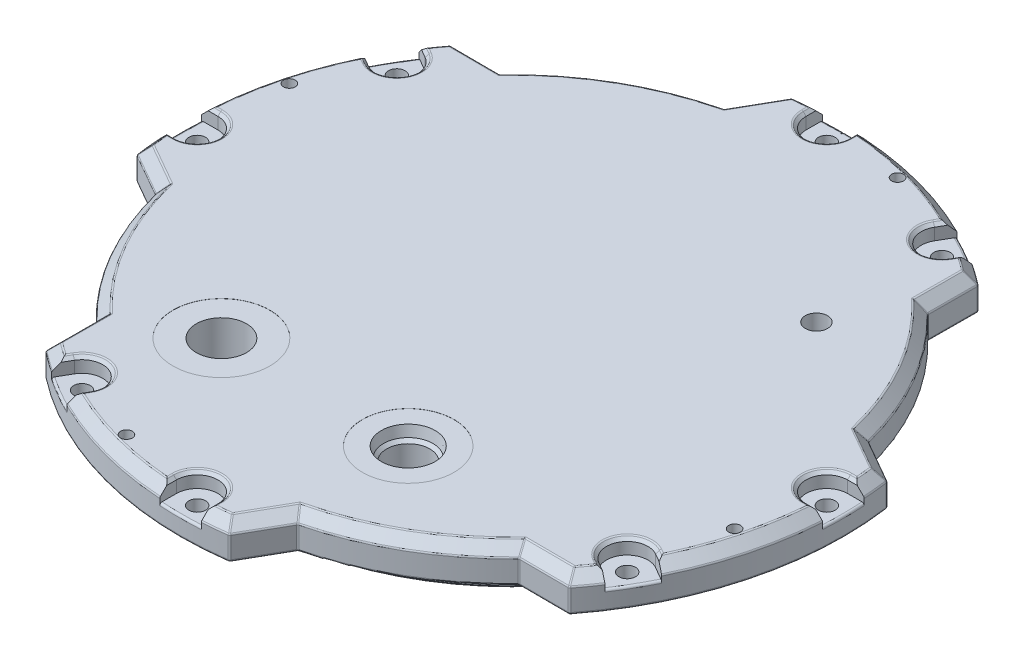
SolidWorks part; units mm, degrees
ref_plane "Front Plane" through (0, 0, 0) normal (0, 0, 1) x (1, 0, 0)
ref_plane "Top Plane" through (0, 0, 0) normal (0, 1, 0) x (1, 0, 0)
ref_plane "Right Plane" through (0, 0, 0) normal (1, 0, 0) x (0, 0, -1)
sketch "Sketch1" plane through (0, 0, 0) normal (0, 0, 1) x (1, 0, 0)
  line L0 (0, 0) -> (0, 13.4937)
  line L1 (0, 13.4937) -> (76.2, 13.4937)
  line L2 (76.2, 13.4937) -> (76.2, 5.5562)
  line L3 (76.2, 5.5562) -> (60.2996, 5.5562)
  line L4 (60.2996, 5.5562) -> (60.2996, 0)
  line L5 (60.2996, 0) -> (55.5625, 0)
  line L6 (0, 0) -> (0, -19.4139) construction
  line L7 (55.5625, 0) -> (53.2417, 0)
  line L8 (53.2417, 0) -> (0, 0)
  dimension "D1" = 152.4
  dimension "D2" = 120.5992
  dimension "D3" = 13.4937
  dimension "D4" = 7.9375
  dimension "D6" = 55.5625
revolve "Revolve1" add sketch "Sketch1" angle 360 about L6
ref_plane "Plane1" through (0, 0, 0) normal (0, 0, 1) x (1, 0, 0)
sketch "Sketch3" plane through (0, 0, 0) normal (0, 0, 1) x (1, 0, 0)
  line L0 (59.2869, 3.989) -> (60.2996, 4.0776)
  line L1 (60.2996, 4.0776) -> (60.2996, 1.4977)
  line L2 (60.2996, 1.4977) -> (59.2869, 1.5863)
  line L3 (59.055, 1.8393) -> (59.055, 3.736)
  line L4 (0, 50) -> (0, -50) construction
  line L5 (60.2996, 0) -> (60.2996, 5.5562) construction
  line L6 (59.2869, 3.989) -> (59.055, 3.9687) construction
  line L7 (59.2869, 1.5863) -> (59.055, 1.6065) construction
  line L8 (59.055, 1.8393) -> (59.055, 1.6065) construction
  line L9 (59.055, 3.736) -> (59.055, 3.9687) construction
  line L10 (59.055, 3.9687) -> (62.6971, 3.9687) construction
  line L11 (59.055, 1.6065) -> (62.6971, 1.6065) construction
  line L12 (-76.2, 5.5562) -> (76.2, 5.5562) construction
  line L13 (-60.2996, 0) -> (60.2996, 0) construction
  arc A0 (59.2869, 1.5863) -> (59.055, 1.8393) centre (59.309, 1.8393) cw
  arc A1 (59.055, 3.736) -> (59.2869, 3.989) centre (59.309, 3.736) cw
  dimension "D6" = 0.254
  dimension "D1" = 118.11
  dimension "D2" = 2.3622
  dimension "D3" = 1.6065
  dimension "D4" = 5
  dimension "D5" = 10
  dimension "D7" = 1.5875
revolve "Groove for AS 568-046, O-Ring1" cut sketch "Sketch3"
sketch "Sketch11" plane through (0, 0, 0) normal (0, 0, 1) x (1, 0, 0)
  line L0 (-76.2, 5.5562) -> (76.2, 5.5562) construction
  line L1 (63.3603, 5.5562) -> (65.9257, 5.5562)
  line L2 (63.3603, 5.5562) -> (63.3603, 6.8262)
  line L3 (63.3603, 6.8262) -> (65.9257, 6.8262)
  line L4 (65.9257, 5.5562) -> (65.9257, 6.8262)
  line L5 (0, 0) -> (0, -14.4596) construction
  line L6 (0, 37.2738) -> (0, -63.3395) construction
  line L7 (0, 5.5562) -> (0, 13.4937) construction
  dimension "D1" = 126.7206
  dimension "D2" = 2.5654
  dimension "D3" = 1.27
revolve "#2-049" cut sketch "Sketch11" angle 360 about L5
chamfer "Chamfer2" distance 0.508 angle 45 1 edges at (-60.2996, 0, 0)
hole_wizard "CBORE for #6 Socket Head Cap Screw1" positions "Sketch5" profile "Sketch4" counterbore size "#6" standard "ANSI Inch"
sketch "Sketch5" plane through (0, 13.4937, 0) normal (0, 1, 0) x (1, 0, 0)
  line L1 (0, 0) -> (0, 72.2313) construction
  circle A0 centre (0, 0) radius 72.2313 construction
  point P0 (0, 72.2313)
  dimension "D1" = 144.4625
sketch "Sketch4" plane through (0, 13.4937, -72.2313) normal (1, 0, 0) x (0, 0, 1)
  line L0 (0, 0) -> (0, 13.4938)
  line L1 (0, 13.4938) -> (1.8986, 13.4938)
  line L3 (1.8986, 13.4938) -> (1.8987, 3.5052)
  line L4 (1.8987, 3.5052) -> (4.7625, 3.5052)
  line L5 (4.7625, 3.5052) -> (4.7625, 0)
  line L7 (4.7625, 0) -> (0, 0)
  line L11 (0, -6.35) -> (0, 107.95) construction
  dimension "Thru Hole Dia." = 3.7973
  dimension "Thru Hole Depth" = 13.4938
  dimension "C'Bore Dia." = 9.525
  dimension "C'Bore Depth" = 3.5052
sketch "Sketch65" plane through (0, 13.4937, 0) normal (0, 1, 0) x (1, 0, 0)
  line L0 (4.7625, 72.2313) -> (4.7625, 81.7999)
  line L1 (-4.7625, 72.2312) -> (-4.7625, 81.7999)
  line L2 (-4.7625, 81.7999) -> (4.7625, 81.7999)
  arc A0 (-2.7035, 76.152) -> (2.7035, 76.152) centre (0, 72.2313) ccw construction
  arc A1 (-4.7625, 72.2312) -> (4.7625, 72.2313) centre (0, 72.2313) ccw
extrude "Cut-Extrude5" cut sketch "Sketch65" against normal up to surface (3.5052 mm away)
pattern_circular "CirPattern1" count 12 over 360 about axis through (0, 0, 0) along (0, 1, 0) of "CBORE for #6 Socket Head Cap Screw1", "Cut-Extrude5"
sketch "Sketch10" plane through (0, 13.4937, 0) normal (0, 1, 0) x (1, 0, 0)
  line L0 (0, 0) -> (-62.5541, -36.1156) construction
  line L1 (0, 0) -> (-65.4585, -16.3206) construction
  line L2 (0, 0) -> (-46.8633, -48.5284) construction
  line L3 (0, 0) -> (-75.4584, -10.605) construction
  line L4 (0, 0) -> (-46.9134, -60.0464) construction
  line L5 (-65.4585, -16.3206) -> (-75.4584, -10.605)
  line L6 (-46.8633, -48.5284) -> (-46.9134, -60.0464)
  arc A0 (-65.4585, -16.3206) -> (-46.8633, -48.5284) centre (0, 0) ccw
  arc A2 (-75.4584, -10.605) -> (-46.9134, -60.0464) centre (0, 0) ccw
  dimension "D1" = 134.9248
  dimension "D6" = 76.2
  dimension "D2" = 16
  dimension "D3" = 16
  dimension "D4" = 22
  dimension "D5" = 22
extrude "Cut-Extrude2" cut sketch "Sketch10" against normal up to next
pattern_circular "CirPattern2" count 4 over 360 about axis through (0, 0, 0) along (0, 1, 0) of "Cut-Extrude2"
hole_wizard "#6-32 Tapped Hole1" positions "Sketch27" profile "Sketch26" tap size "#6-32" standard "ANSI Inch"
sketch "Sketch27" plane through (0, 13.4937, 0) normal (0, 1, 0) x (1, 0, 0)
  line L0 (0, 0) -> (18.6948, 69.77) construction
  line L1 (0, 0) -> (0, 82.7753) construction
  circle A0 centre (0, 0) radius 72.2313 construction
  point P0 (18.6948, 69.77)
  dimension "D2" = 144.4625
  dimension "D1" = 15
sketch "Sketch26" plane through (18.6948, 13.4937, -69.77) normal (1, 0, 0) x (0, 0, 1)
  line L0 (0, 0) -> (0, 13.4938)
  line L1 (0, 13.4938) -> (1.3525, 13.4938)
  line L2 (1.3525, 13.4938) -> (1.3525, 0)
  line L5 (1.3525, 0) -> (0, 0)
  line L11 (0, -6.35) -> (0, 107.95) construction
  dimension "Thru Tap Drill Dia." = 2.7051
  dimension "Thru Tap Drill Depth" = 13.4938
pattern_circular "CirPattern3" count 4 over 360 about axis through (0, 0, 0) along (0, 1, 0) of "#6-32 Tapped Hole1"
chamfer "Chamfer4" distance 2.3812 angle 45 24 edges at (13.4628, 13.4937, 70.4585) (-44.5648, 13.4937, 61.8095) (7.6895, 13.4937, 75.811) (-46.8884, 13.4937, 54.2874) (-58.4242, 13.4937, 33.7312) (-70.4585, 13.4937, 13.4628) (-61.8095, 13.4937, -44.5648) (-75.811, 13.4937, 7.6895) (-54.2874, 13.4937, -46.8884) (-33.7312, 13.4937, -58.4242) (-13.4628, 13.4937, -70.4585) (-7.6895, 13.4937, -75.811) (44.5648, 13.4937, -61.8095) (46.8884, 13.4937, -54.2874) (58.4242, 13.4937, -33.7312) (70.4585, 13.4937, -13.4628) (61.8095, 13.4937, 44.5648) (75.811, 13.4937, -7.6895) (54.2874, 13.4937, 46.8884) (33.7312, 13.4937, 58.4242) (19.722, 13.4937, -73.6035) (73.6035, 13.4937, 19.722) (-19.722, 13.4937, 73.6035) (-73.6035, 13.4937, -19.722)
chamfer "Chamfer5" distance 0.7937 angle 45 24 edges at (0, 13.4937, -67.4687) (33.7344, 13.4937, -58.4297) (67.4688, 13.4937, 0) (58.4297, 13.4937, 33.7344) (0, 13.4937, 67.4688) (-33.7344, 13.4937, 58.4297) (-67.4688, 13.4937, 0) (-58.4297, 13.4937, -33.7344) (4.7625, 13.4937, -72.9481) (-4.7625, 13.4937, -72.9481) (32.3496, 13.4937, -65.5562) (40.5985, 13.4937, -60.7937) (72.9481, 13.4937, -4.7625) (72.9481, 13.4937, 4.7625) (65.5562, 13.4937, 32.3496) (60.7937, 13.4937, 40.5985) (4.7625, 13.4937, 72.9481) (-4.7625, 13.4937, 72.9481) (-32.3496, 13.4937, 65.5562) (-40.5985, 13.4937, 60.7937) (-72.9481, 13.4937, 4.7625) (-72.9481, 13.4937, -4.7625) (-65.5562, 13.4937, -32.3496) (-60.7937, 13.4937, -40.5985)
sketch "Sketch6" plane through (0, 5.5562, 0) normal (0, -1, 0) x (1, 0, 0)
  line L1 (0, 0) -> (0, -86.5299) construction
  line L2 (0, -75.4062) -> (-4.6076, -86.5299)
  line L3 (0, -75.4062) -> (4.6076, -86.5299)
  line L4 (4.6076, -86.5299) -> (0, -86.5299)
  line L5 (0, -86.5299) -> (-4.6076, -86.5299)
  dimension "D2" = 45
  dimension "D3" = 75.4062
extrude "FWD Index Mark" cut sketch "Sketch6" against normal through all
hole_wizard "7/16 Clearance Hole1" positions "Sketch16" profile "Sketch15" hole size "7/16" standard "ANSI Inch"
sketch "Sketch16" plane through (0, 13.4937, 0) normal (0, 1, 0) x (1, 0, 0)
  line L0 (0, 0) -> (0, -45.7031) construction
  point P0 (-26.9875, -39.6875)
  dimension "D1" = 26.9875
  dimension "D2" = 39.6875
sketch "Sketch15" plane through (-26.9875, 13.4937, 39.6875) normal (1, 0, 0) x (0, 0, 1)
  line L0 (0, 0) -> (0, 13.4938)
  line L1 (0, 13.4938) -> (5.7544, 13.4938)
  line L2 (5.7544, 13.4938) -> (5.7544, 0)
  line L5 (5.7544, 0) -> (0, 0)
  line L11 (0, -6.35) -> (0, 107.95) construction
  dimension "Thru Hole Dia." = 11.5087
  dimension "Thru Hole Depth" = 13.4938
sketch "Sketch17" plane through (0, 0, 0) normal (0, -1, 0) x (1, 0, 0)
  arc A0 (-44.0352, 33.8835) -> (-15.3229, 53.4079) centre (0, 0) ccw
  arc A1 (-36.2788, 33.5917) -> (-17.9029, 46.0873) centre (-26.9875, 39.6875) ccw
  arc A2 (-15.3229, 53.4079) -> (-17.9029, 46.0873) centre (-14.0095, 48.8301) ccw
  arc A3 (-36.2788, 33.5917) -> (-44.0352, 33.8835) centre (-40.2608, 30.9792) ccw
  dimension "D1" = 111.125
  dimension "D2" = 22.225
  dimension "D3" = 9.525
extrude "Cut-Extrude4" cut sketch "Sketch17" against normal blind 0.7937
sketch "Sketch18" plane through (0, 13.4937, 0) normal (0, 1, 0) x (1, 0, 0)
  circle A0 centre (-26.9875, -39.6875) radius 11.1125
  dimension "D1" = 22.225
extrude "SpotFace" cut sketch "Sketch18" against normal blind 0.0254
hole_wizard "1/4-20 Tapped Hole3" positions "Sketch22" profile "Sketch21" tap size "1/4-20" standard "ANSI Inch"
sketch "Sketch22" plane through (0, 13.4937, 0) normal (0, 1, 0) x (1, 0, 0)
  circle A0 centre (38.1, 31.75) radius 11.5094 construction
  point P0 (38.1, 31.75)
  dimension "D1" = 23.0188
  dimension "D2" = 31.75
  dimension "D3" = 38.1
sketch "Sketch21" plane through (38.1, 13.4937, -31.75) normal (1, 0, 0) x (0, 0, 1)
  line L0 (0, 0) -> (0, 9.7888)
  line L1 (0, 9.7888) -> (2.5527, 8.255)
  line L2 (2.5527, 8.255) -> (2.5527, 0)
  line L5 (2.5527, 0) -> (0, 0)
  line L10 (0, 9.7888) -> (-2.5527, 8.255) construction
  line L11 (0, -6.35) -> (0, 107.95) construction
  dimension "Tap Drill Dia." = 5.1054
  dimension "Tap Drill Depth" = 8.255
  dimension "Drill Angle" = 118
hole_wizard "#4-40 Tapped Hole1 Grnd Lug" positions "Sketch25" profile "Sketch24" tap size "#4-40" standard "ANSI Inch"
sketch "Sketch25" plane through (0, 0.7937, 0) normal (0, -1, 0) x (-1, 0, 0)
  line L0 (0, 0) -> (0, -42.8625) construction
  point P0 (0, -42.8625)
  dimension "D1" = 42.8625
sketch "Sketch24" plane through (0, 0.7937, 42.8625) normal (1, 0, 0) x (0, 0, -1)
  line L0 (0, 0) -> (0, 10.2042)
  line L1 (0, 10.2042) -> (1.1303, 9.525)
  line L2 (1.1303, 9.525) -> (1.1303, 0)
  line L5 (1.1303, 0) -> (0, 0)
  line L10 (0, 10.2042) -> (-1.1303, 9.525) construction
  line L11 (0, -6.35) -> (0, 107.95) construction
  dimension "Tap Drill Dia." = 2.2606
  dimension "Tap Drill Depth" = 9.525
  dimension "Drill Angle" = 118
hole_wizard "#2-56 Tapped Holes 3 PNI" positions "Sketch13" profile "Sketch12" tap size "#2-56" standard "ANSI Inch"
sketch "Sketch13" plane through (0, 0, 0) normal (0, -1, 0) x (-1, 0, 0)
  point P0 (13.5, 48.9313)
  point P3 (13.5, 19.9313)
  point P5 (-13.5, 34.9313)
  dimension "D1" = 13.5
  dimension "D2" = 13.5
  dimension "D3" = 13.5
  dimension "D4" = 34.9313
  dimension "D5" = 19.9313
  dimension "D6" = 48.9313
  dimension "D7" = 27
  dimension "D8" = 29
sketch "Sketch12" plane through (-13.5, 0, -48.9313) normal (1, 0, 0) x (0, 0, -1)
  line L0 (0, 0) -> (0, 7.189)
  line L1 (0, 7.189) -> (0.889, 6.6548)
  line L2 (0.889, 6.6548) -> (0.889, 0)
  line L5 (0.889, 0) -> (0, 0)
  line L10 (0, 7.189) -> (-0.889, 6.6548) construction
  line L11 (0, -6.35) -> (0, 107.95) construction
  dimension "Tap Drill Dia." = 1.778
  dimension "Tap Drill Depth" = 6.6548
  dimension "Drill Angle" = 118
hole_wizard "#6-32 Tapped Hole RackingHoles" positions "Sketch29" profile "Sketch28" tap size "#6-32" standard "ANSI Inch"
sketch "Sketch29" plane through (0, 0.7937, 0) normal (0, -1, 0) x (-1, 0, 0)
  point P0 (47.625, 0)
  point P1 (-47.625, 0)
  dimension "D1" = 47.625
  dimension "D2" = 47.625
sketch "Sketch28" plane through (-47.625, 0.7937, 0) normal (1, 0, 0) x (0, 0, -1)
  line L0 (0, 0) -> (0, 6.3753)
  line L1 (0, 6.3753) -> (1.3525, 5.5626)
  line L2 (1.3525, 5.5626) -> (1.3525, 0)
  line L5 (1.3525, 0) -> (0, 0)
  line L10 (0, 6.3753) -> (-1.3526, 5.5626) construction
  line L11 (0, -6.35) -> (0, 107.95) construction
  dimension "Tap Drill Dia." = 2.7051
  dimension "Tap Drill Depth" = 5.5626
  dimension "Drill Angle" = 118
hole_wizard "SAE#4" positions "Sketch2" profile "Sketch33" legacy
sketch "Sketch2" plane through (79.1756, 13.4937, 103.4985) normal (0, 1, 0) x (-1, 0, 0)
  point P0 (63.3006, -63.811)
  dimension "D1" = 15.875
  dimension "D2" = 39.6875
sketch "Sketch33" plane through (15.875, 13.4937, 39.6875) normal (1, 0, 0) x (0, 0, 1)
  line L0 (0, 0) -> (0, 13.8938)
  line L1 (0, 13.8938) -> (4.9657, 13.8938)
  line L2 (4.9657, 13.8938) -> (4.9657, 3.0793)
  line L3 (5.6828, 2.3622) -> (6.1849, 0)
  line L4 (6.1849, 0) -> (0, 0)
  line L5 (0, -6.4453) -> (0, 42.3633) construction
  line L6 (-5.5562, 2.9576) -> (-6.1849, 0) construction
  line L7 (4.9657, 3.0793) -> (5.6828, 2.3622)
  line L9 (4.7901, 0) -> (23.6971, 0) construction
  dimension "Diameter" = 9.9314
  dimension "Depth" = 13.8938
  dimension "C-Sink Angle" = 24
  dimension "C-Sink Diameter" = 12.3698
sketch "Sketch64" plane through (14.1913, 13.4937, 39.4233) normal (0, 1, 0) x (-1, 0, 0)
  circle A0 centre (-1.6837, 0.2642) radius 10.5156
  dimension "D1" = 21.0312
extrude "S.F. Cut-Extrude1" cut sketch "Sketch64" against normal blind 0.0254
fillet "Anodizw Fillet Rev.F" radius 0.508 98 edges at (56.3619, 13.4937, -32.5406) (31.6483, 13.4937, -65.929) (33.3375, 13.4937, -57.7422) (41.272, 13.4937, -60.3727) (43.0845, 13.4937, -59.9411) (44.5023, 13.4937, -53.1942) (68.3187, 13.4937, -11.943) (73.4528, 13.4937, -7.3417) (72.9203, 13.4937, -5.5562) (66.675, 13.4937, 0) (72.9203, 13.4937, 5.5563) (71.3034, 13.4937, 19.1057) (65.929, 13.4937, 31.6483) (57.7422, 13.4937, 33.3375) (60.3727, 13.4937, 41.272) (59.9411, 13.4937, 43.0845) (53.1942, 13.4937, 44.5023) (32.5406, 13.4937, 56.3619) (11.943, 13.4937, 68.3187) (7.3417, 13.4937, 73.4528) (5.5563, 13.4937, 72.9203) (0, 13.4937, 66.675) (-5.5563, 13.4937, 72.9203) (-19.1057, 13.4937, 71.3034) (-31.6483, 13.4937, 65.929) (-33.3375, 13.4937, 57.7422) (-41.272, 13.4937, 60.3727) (-43.0845, 13.4937, 59.9411) (-44.5023, 13.4937, 53.1942) (-56.3619, 13.4937, 32.5406) (-68.3187, 13.4937, 11.943) (-73.4528, 13.4937, 7.3417) (-72.9203, 13.4937, 5.5562) (-66.675, 13.4937, 0) (-72.9203, 13.4937, -5.5563) (-71.3034, 13.4937, -19.1057) (-65.929, 13.4937, -31.6483) (-57.7422, 13.4937, -33.3375) (-60.3727, 13.4937, -41.272) (-59.9411, 13.4937, -43.0845) (-53.1942, 13.4937, -44.5023) (-32.5406, 13.4937, -56.3619) (-11.943, 13.4937, -68.3187) (-7.3417, 13.4937, -73.4528) (-5.5563, 13.4937, -72.9203) (0, 13.4937, -66.675) (5.5563, 13.4937, -72.9203) (19.1057, 13.4937, -71.3034) (44.5648, 11.1125, -61.8095) (46.8884, 11.1125, -54.2874) (58.4242, 11.1125, -33.7312) (70.4585, 11.1125, -13.4628) (75.811, 11.1125, -7.6895) (73.6035, 11.1125, 19.722) (61.8095, 11.1125, 44.5648) (54.2874, 11.1125, 46.8884) (33.7312, 11.1125, 58.4242) (13.4628, 11.1125, 70.4585) (7.6895, 11.1125, 75.811) (-19.722, 11.1125, 73.6035) (-44.5648, 11.1125, 61.8095) (-46.8884, 11.1125, 54.2874) (-58.4242, 11.1125, 33.7312) (-70.4585, 11.1125, 13.4628) (-75.811, 11.1125, 7.6895) (-73.6035, 11.1125, -19.722) (-61.8095, 11.1125, -44.5648) (-54.2874, 11.1125, -46.8884) (-33.7312, 11.1125, -58.4242) (-13.4628, 11.1125, -70.4585) (-7.6895, 11.1125, -75.811) (19.722, 11.1125, -73.6035) (46.8884, 5.5562, -54.2874) (58.4242, 5.5562, -33.7312) (70.4585, 5.5562, -13.4628) (73.6035, 5.5562, 19.722) (54.2874, 5.5562, 46.8884) (33.7312, 5.5562, 58.4242) (13.4628, 5.5562, 70.4585) (-19.722, 5.5562, 73.6035) (-46.8884, 5.5562, 54.2874) (-58.4242, 5.5562, 33.7312) (-70.4585, 5.5562, 13.4628) (-73.6035, 5.5562, -19.722) (-54.2874, 5.5562, -46.8884) (-33.7312, 5.5562, -58.4242) (-13.4628, 5.5562, -70.4585) (-5.4793, 5.5562, -76.0027) (24.9635, 5.5562, -71.9949) (38.1, 9.9885, -65.9911) (76.2, 9.9885, 0) (65.9911, 9.9885, 38.1) (0, 9.9885, 76.2) (-38.1, 9.9885, 65.9911) (-76.2, 9.9885, 0) (-65.9911, 9.9885, -38.1) (-2.5466, 9.9885, -76.1574) (2.5466, 9.9885, -76.1574)
fillet "Fillet2" radius 0.508 80 edges at (46.8201, 5.7711, -60.0012) (44.5273, 13.448, -58.8776) (46.889, 11.0575, -60.0346) (75.3726, 5.7711, -10.5468) (73.2531, 13.448, -9.123) (75.436, 11.0575, -10.5898) (60.0012, 5.7711, 46.8201) (58.8776, 13.448, 44.5273) (60.0346, 11.0575, 46.889) (10.5468, 5.7711, 75.3726) (9.123, 13.448, 73.2531) (10.5898, 11.0575, 75.436) (-46.8201, 5.7711, 60.0012) (-44.5273, 13.448, 58.8776) (-46.889, 11.0575, 60.0346) (-75.3726, 5.7711, 10.5468) (-73.2531, 13.448, 9.123) (-75.436, 11.0575, 10.5898) (-60.0012, 5.7711, -46.8201) (-58.8776, 13.448, -44.5273) (-60.0346, 11.0575, -46.889) (-10.5468, 5.7711, -75.3726) (-10.605, 8.4832, -75.4584) (-10.5898, 11.0575, -75.436) (-9.123, 13.448, -73.2531) (46.9134, 8.4832, -60.0464) (75.4584, 8.4832, -10.605) (60.0464, 8.4832, 46.9134) (10.605, 8.4832, 75.4584) (-46.9134, 8.4832, 60.0464) (-75.4584, 8.4832, 10.605) (-60.0464, 8.4832, -46.9134) (46.7664, 5.766, -48.4875) (44.48, 13.4471, -47.512) (46.838, 11.0602, -48.5177) (65.3746, 5.766, -16.2571) (63.3866, 13.4471, -14.7648) (65.4366, 11.0602, -16.3041) (48.4875, 5.766, 46.7664) (47.512, 13.4471, 44.48) (48.5177, 11.0602, 46.838) (16.2571, 5.766, 65.3746) (14.7648, 13.4471, 63.3866) (16.3041, 11.0602, 65.4366) (-46.7664, 5.766, 48.4875) (-44.48, 13.4471, 47.512) (-46.838, 11.0602, 48.5177) (-65.3746, 5.766, 16.2571) (-63.3866, 13.4471, 14.7648) (-65.4366, 11.0602, 16.3041) (-48.4875, 5.766, -46.7664) (-47.512, 13.4471, -44.48) (-48.5177, 11.0602, -46.838) (-16.2571, 5.766, -65.3746) (-14.7648, 13.4471, -63.3866) (-16.3041, 11.0602, -65.4366) (46.8633, 8.4832, -48.5284) (65.4585, 8.4832, -16.3206) (48.5284, 8.4832, 46.8633) (16.3206, 8.4832, 65.4585) (-46.8633, 8.4832, 48.5284) (-65.4585, 8.4832, 16.3206) (-48.5284, 8.4832, -46.8633) (-16.3206, 8.4832, -65.4585)
equation "\"Buoyancy\"= \"SW-Volume\" * ( \"SW-Density\" - .037062 )"
